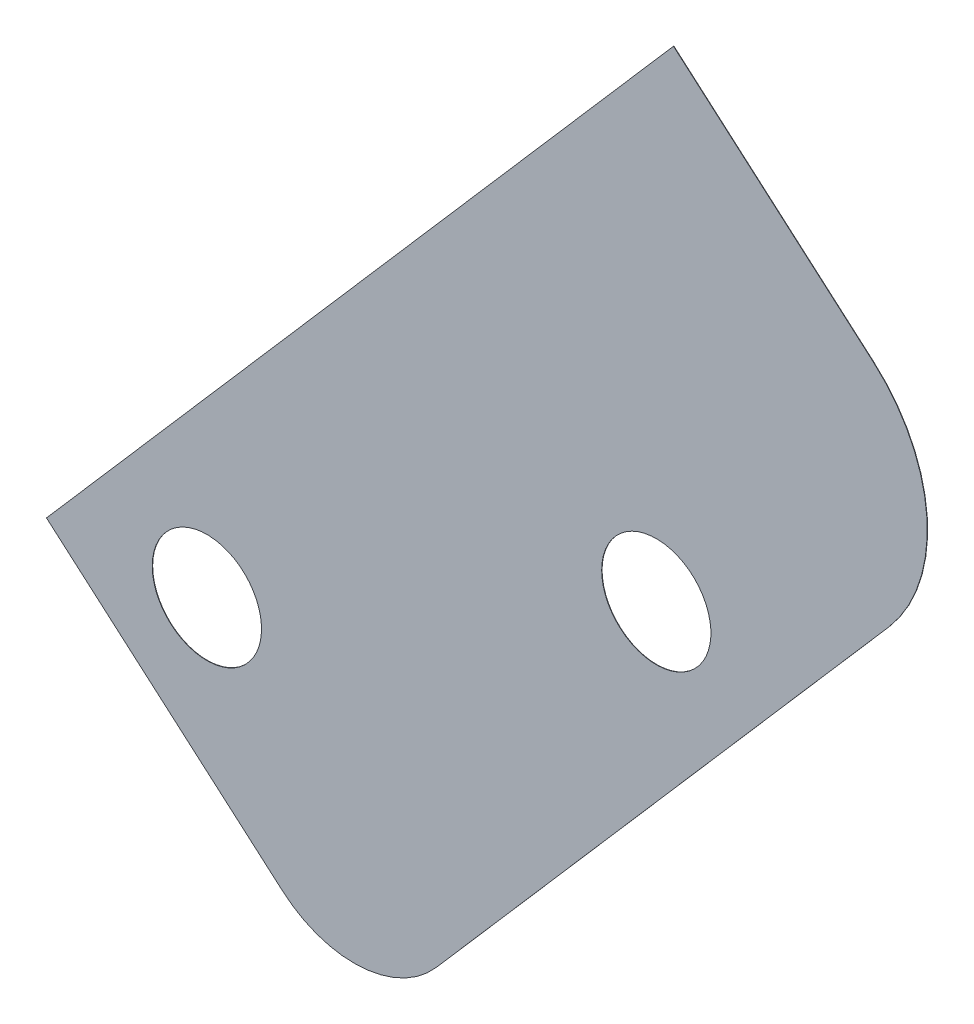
SolidWorks part; units mm, degrees
ref_plane "Front" through (0, 0, 0) normal (0, 0, 1) x (1, 0, 0)
ref_plane "Top" through (0, 0, 0) normal (0, 1, 0) x (1, 0, 0)
ref_plane "Right" through (0, 0, 0) normal (1, 0, 0) x (0, 0, -1)
sketch "Sketch1" plane through (0, 0, 0) normal (0, 0, 1) x (1, 0, 0)
  line L8 (-650.4904, -114.9973) -> (-620.9286, -80.9567)
  line L9 (-621.9505, -66.4447) -> (-634.9914, -55.1196)
  line L10 (-634.9914, -55.1196) -> (-675.9616, -102.2969)
  line L11 (-675.9616, -102.2969) -> (-660.5235, -115.7038)
  line L12 (-650.4904, -114.9973) -> (-620.9286, -80.9567)
  line L13 (-621.9505, -66.4447) -> (-634.9914, -55.1196)
  line L14 (-634.9914, -55.1196) -> (-675.9616, -102.2969)
  line L15 (-675.9616, -102.2969) -> (-660.5235, -115.7038)
  arc A4 (-620.9286, -80.9567) -> (-621.9505, -66.4447) centre (-628.6956, -74.2116) ccw
  arc A5 (-660.5235, -115.7038) -> (-650.4904, -114.9973) centre (-655.8602, -110.334) ccw
  arc A6 (-620.9286, -80.9567) -> (-621.9505, -66.4447) centre (-628.6956, -74.2116) ccw
  arc A7 (-660.5235, -115.7038) -> (-650.4904, -114.9973) centre (-655.8602, -110.334) ccw
  dimension "D1" = 0.508
extrude "Boss-Extrude1" add sketch "Sketch1" along normal blind 0.0254 separate body
hole_wizard "Hole1" positions "Point_Sketch" profile "Profil_Sketch" hole size "Ø0.15" standard "ISO"
sketch "Point_Sketch" plane through (-661.8264, -90.9577, 0) normal (0, 0, 1) x (-1, 0, 0)
  point P0 (3.6543, 10.6011)
  point P2 (-25.7119, -3.8452)
sketch "Profil_Sketch" plane through (-665.4806, -101.5588, 0) normal (1, 0, 0) x (0, 1, 0)
  line L0 (0, 0) -> (0, 0.0254)
  line L1 (0, 0.0254) -> (3.5687, 0.0254)
  line L2 (3.5687, 0.0254) -> (3.5687, 0)
  line L5 (3.5687, 0) -> (0, 0)
  line L11 (0, -6.35) -> (0, 107.95) construction
  dimension "Diameter" = 7.1374
  dimension "Thru Hole Depth" = 0.0254
other "usin_DL090_.25-20x3-SHCS<1>"
